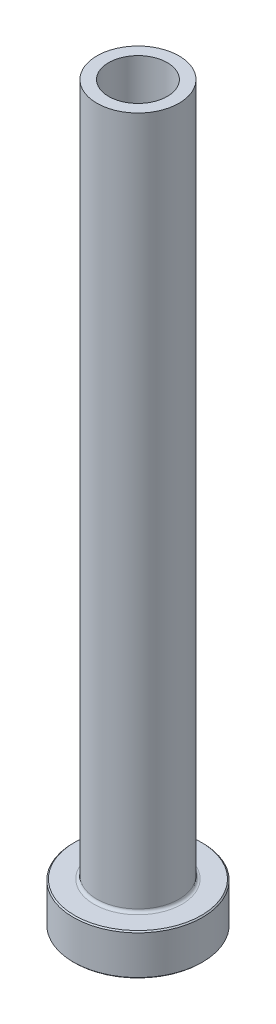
SolidWorks part; units mm, degrees
ref_plane "Front Plane" through (0, 0, 0) normal (0, 0, 1) x (1, 0, 0)
ref_plane "Top Plane" through (0, 0, 0) normal (0, 1, 0) x (1, 0, 0)
ref_plane "Right Plane" through (0, 0, 0) normal (1, 0, 0) x (0, 0, -1)
sketch "Sketch1" plane through (0, 0, 0) normal (0, 0, 1) x (1, 0, 0)
  line L0 (-5, 125) -> (-7, 125)
  line L1 (-7, 125) -> (-7, 7)
  line L2 (-7, 7) -> (-11, 7)
  line L3 (-11, 7) -> (-11, 0)
  line L4 (12.1, 0) -> (-12.1, 0) construction
  line L5 (-11, 0) -> (-5.25, 0)
  line L6 (-5, 80) -> (-5, 125)
  line L7 (0, 92.1877) -> (0, -15.5353) construction
  line L8 (0, -12.1) -> (0, 12.1) construction
  line L9 (-5, 80) -> (-5.25, 68)
  line L10 (-5.25, 68) -> (-5.25, 0)
  dimension "D1" = 0.25
  dimension "ID" = 10
  dimension "OD" = 14
  dimension "L" = 125
  dimension "H" = 22
  dimension "T" = 7
  dimension "N" = 45
  dimension "D2" = 12
revolve "Revolve1" add sketch "Sketch1" angle 360 about L7
fillet "Fillet1" radius 0.5 1 edges at (0, 7, 7)
chamfer "Chamfer1" distance 0.2 angle 45 2 edges at (0, 7, 11) (0, 0, 11)
chamfer "Chamfer3" distance 0.5 angle 45 1 edges at (0, 0, 5.25)
